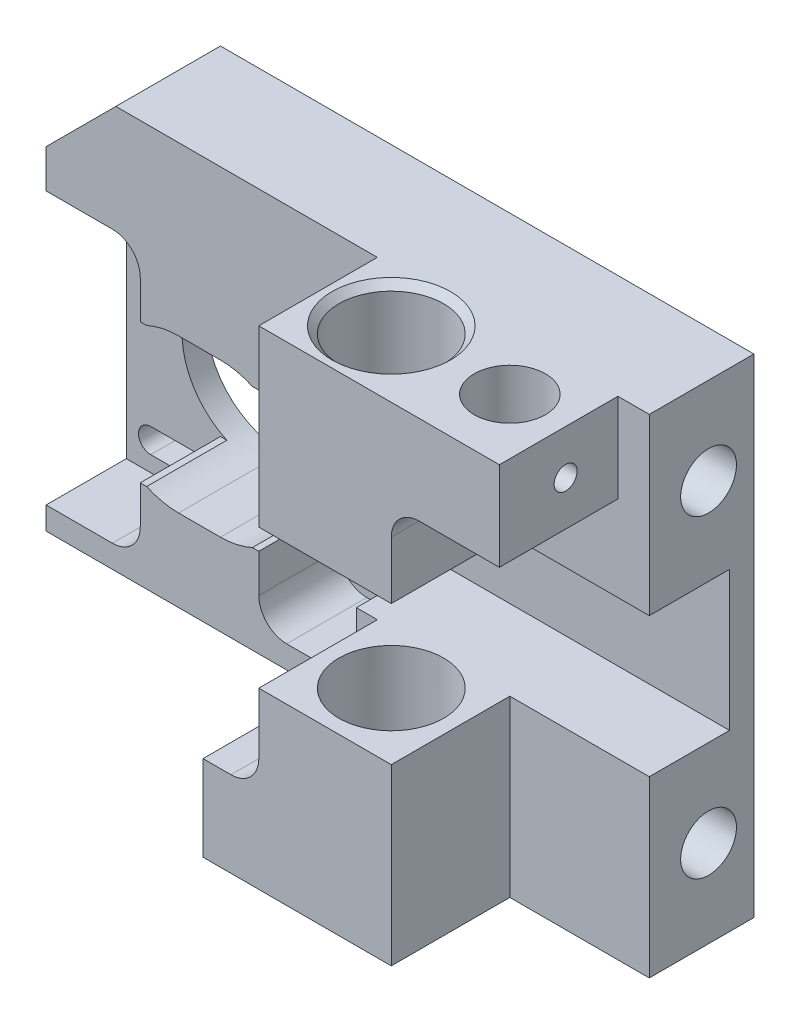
SolidWorks part; units mm, degrees
ref_plane "Plan de face" through (0, 0, 0) normal (0, 0, 1) x (1, 0, 0)
ref_plane "Plan de dessus" through (0, 0, 0) normal (0, 1, 0) x (1, 0, 0)
ref_plane "Plan de droite" through (0, 0, 0) normal (1, 0, 0) x (0, 0, -1)
sketch "Esquisse1" plane through (0, 0, 0) normal (0, 0, 1) x (1, 0, 0)
  line L0 (0, 0) -> (-6, 0) construction
  line L1 (0, -11) -> (-6, -11)
  line L2 (0, 11) -> (-6, 11)
  line L3 (0, 20.2026) -> (0, -14.7359) construction
  line L4 (-16.8352, 0) -> (12.3944, 0) construction
  line L5 (-15.5, 15.5) -> (-21.5, 15.5) construction
  line L6 (-15.5, 13.75) -> (-21.5, 13.75)
  line L7 (-15.5, 17.25) -> (-21.5, 17.25)
  line L8 (-15.5, -15.5) -> (-21.5, -15.5) construction
  line L9 (-15.5, -13.75) -> (-21.5, -13.75)
  line L10 (-15.5, -17.25) -> (-21.5, -17.25)
  line L11 (9.5, 15.5) -> (15.5, 15.5) construction
  line L12 (9.5, 17.25) -> (15.5, 17.25)
  line L13 (9.5, 13.75) -> (15.5, 13.75)
  line L14 (9.5, -15.5) -> (15.5, -15.5) construction
  line L15 (9.5, -17.25) -> (15.5, -17.25)
  line L16 (9.5, -13.75) -> (15.5, -13.75)
  line L17 (-25, 30.25) -> (-25, -22.75)
  line L18 (-25, -22.75) -> (14.5, -22.75)
  line L19 (14.5, -22.75) -> (14.5, -29.75)
  line L20 (14.5, -29.75) -> (61.5, -29.75)
  line L21 (61.5, -29.75) -> (61.5, 30.25)
  line L22 (61.5, 30.25) -> (-25, 30.25)
  arc A0 (0, -11) -> (0, 11) centre (0, 0) ccw
  arc A1 (-6, 11) -> (-6, -11) centre (-6, 0) ccw
  arc A2 (-15.5, 13.75) -> (-15.5, 17.25) centre (-15.5, 15.5) ccw
  arc A3 (-21.5, 17.25) -> (-21.5, 13.75) centre (-21.5, 15.5) ccw
  arc A4 (-15.5, -13.75) -> (-15.5, -17.25) centre (-15.5, -15.5) cw
  arc A5 (-21.5, -17.25) -> (-21.5, -13.75) centre (-21.5, -15.5) cw
  arc A6 (9.5, 17.25) -> (9.5, 13.75) centre (9.5, 15.5) ccw
  arc A7 (15.5, 13.75) -> (15.5, 17.25) centre (15.5, 15.5) ccw
  arc A8 (9.5, -17.25) -> (9.5, -13.75) centre (9.5, -15.5) cw
  arc A9 (15.5, -13.75) -> (15.5, -17.25) centre (15.5, -15.5) cw
  point P3 (-3, 0)
  point P14 (-18.5, 15.5)
  point P21 (-18.5, -15.5)
  point P28 (12.5, 15.5)
  point P35 (12.5, -15.5)
  dimension "D1" = 15.5
  dimension "D3" = 15.5
  dimension "D2" = 15.5
  dimension "D4" = 25
  dimension "D5" = 86.5
  dimension "D6" = 60
  dimension "D7" = 7
  dimension "D8" = 30.25
  dimension "D9" = 47
extrude "Boss.-Extru.1" add sketch "Esquisse1" along normal blind 32
sketch "Esquisse2" plane through (0, 0, 32) normal (0, 0, 1) x (1, 0, 0)
  line L0 (14.5, -21.75) -> (22.5, -21.75)
  line L1 (22.5, -21.75) -> (22.5, 30.25)
  line L2 (57, 30.25) -> (57, 22.25)
  line L3 (57, 22.25) -> (41.5, 22.25)
  line L4 (41.5, 22.25) -> (41.5, -29.75)
  line L5 (14.5, -22.75) -> (14.5, -21.75)
  line L6 (61.5, 30.25) -> (-25, 30.25)
  line L7 (-25, 30.25) -> (-25, -22.75)
  line L8 (-25, -22.75) -> (14.5, -22.75)
  line L9 (14.5, -22.75) -> (14.5, -29.75)
  line L10 (14.5, -29.75) -> (61.5, -29.75)
  line L11 (61.5, -29.75) -> (61.5, 30.25)
  line L12 (61.5, 30.25) -> (-25, 30.25)
  line L13 (-25, 30.25) -> (-25, -21.75)
  line L15 (14.5, -22.75) -> (14.5, -29.75)
  line L16 (14.5, -29.75) -> (61.5, -29.75)
  line L17 (61.5, -29.75) -> (61.5, 30.25)
  line L18 (14.5, -21.75) -> (-25, -21.75)
  dimension "D2" = 4.5
  dimension "D3" = 34.5
  dimension "D4" = 8
  dimension "D5" = 19
  dimension "D6" = 8
  dimension "D1" = 0
extrude "Enlèv. mat.-Extru.1" cut sketch "Esquisse2" against normal blind 17 contours L5 L0 L1 M17 M15 M16 M10 M7 M8 M9 M28 M25 M26 M27 M32 M29 M30 M31 M24 M21 M22 M23 M14 M11 M12 M13 | L3 L4 L2 M19 M20 M15
sketch "Esquisse3" plane through (0, 30.25, 0) normal (0, 1, 0) x (1, 0, 0)
  line L0 (22.5, -15) -> (22.5, -32) construction
  line L1 (61.5, 0) -> (-25, 0) construction
  circle A0 centre (32, -22.5) radius 7.5
  circle A1 centre (49, -22.5) radius 5
  dimension "D2" = 15
  dimension "D4" = 10
  dimension "D1" = 9.5
  dimension "D3" = 22.5
  dimension "D5" = 17
extrude "Enlèv. mat.-Extru.2" cut sketch "Esquisse3" against normal through all
sketch "Esquisse4" plane through (61.5, 0, 0) normal (1, 0, 0) x (0, 0, -1)
  line L1 (-15, 30.25) -> (0, 30.25) construction
  line L4 (-15, -29.75) -> (-15, 30.25) construction
  line L5 (-15, 22.25) -> (-15, -29.75) construction
  point P0 (-6.5, 24.3339)
  point P1 (-6.5, -20.6661)
  point P4 (-7.5, 30.25)
  dimension "D1" = 6
  dimension "D2" = 45
  dimension "D3" = 8.5
  dimension "D4" = 8.5
hole_wizard "Dégagement M81" positions "Esquisse6" profile "Esquisse5" hole size "M8" standard "ISO"
sketch "Esquisse6" plane through (61.5, 0, 0) normal (1, 0, 0) x (0, 0, -1)
  line L0 (-15, 0) -> (0, 0) construction
  line L1 (0, -29.75) -> (0, 30.25) construction
  point P0 (-6.5, 22.5)
  point P3 (-6.5, -22.5)
  dimension "D1" = 22.5
  dimension "D2" = 45
  dimension "D3" = 6.5
sketch "Esquisse5" plane through (61.5, 22.5, 6.5) normal (0, 1, 0) x (0, 0, -1)
  line L0 (0, 0) -> (0, 42.6651)
  line L1 (0, 42.6651) -> (3.75, 40.5)
  line L2 (3.75, 40.5) -> (3.75, 0)
  line L5 (3.75, 0) -> (0, 0)
  line L10 (0, 42.6651) -> (-3.75, 40.5) construction
  line L11 (0, -6.35) -> (0, 107.95) construction
  dimension "Diamètre du perçage" = 7.5
  dimension "Profondeur du perçage" = 40.5
  dimension "Angle de pointe" = 120
chamfer "Chanfrein2" [suppressed] distance 0.5 angle 45
sketch "Esquisse9" plane through (0, -21.75, 0) normal (0, 1, 0) x (1, 0, 0)
  line L1 (-25, -32) -> (22.5, -32) construction
  point P0 (19, -20.5)
  dimension "D2" = 11.5
hole_wizard "Trou taraudé M41" positions "Esquisse11" profile "Esquisse10" tap size "M4" standard "ISO"
sketch "Esquisse11" plane through (0, -21.75, 0) normal (0, 1, 0) x (1, 0, 0)
  point P0 (19, -20.5)
sketch "Esquisse10" plane through (19, -21.75, 20.5) normal (1, 0, 0) x (0, 0, 1)
  line L0 (0, 0) -> (0, 8)
  line L1 (0, 8) -> (1.65, 8)
  line L2 (1.65, 8) -> (1.65, 0)
  line L5 (1.65, 0) -> (0, 0)
  line L11 (0, -6.35) -> (0, 107.95) construction
  dimension "Diamètre du trou pour taraudage jusqu'au prochain" = 3.3
  dimension "Profondeur du trou pour taraudage jusqu'au prochain" = 8
sketch "Esquisse12" plane through (61.5, 0, 0) normal (1, 0, 0) x (0, 0, -1)
  line L0 (-8.5, 5) -> (-8.5, -5) construction
  line L1 (-3.5, 5) -> (-3.5, -5)
  line L2 (-13.5, 5) -> (-13.5, -5)
  line L3 (-15, 0) -> (0, 0) construction
  line L4 (0, -29.75) -> (0, 30.25) construction
  arc A0 (-3.5, 5) -> (-13.5, 5) centre (-8.5, 5) ccw
  arc A1 (-13.5, -5) -> (-3.5, -5) centre (-8.5, -5) ccw
  point P2 (-8.5, 0)
  dimension "D1" = 8.5
extrude "Enlèv. mat.-Extru.4" cut sketch "Esquisse12" against normal through all
fillet "Congé1" radius 4 2 edges at (22.5, -21.75, 23.5) (41.5, 22.25, 23.5)
sketch "Esquisse14" plane through (0, 30.25, 0) normal (0, 1, 0) x (1, 0, 0)
  line L1 (-25, -15) -> (-25, 0) construction
  line L2 (-25, -15) -> (-25, 0)
  line L8 (61.5, 0) -> (-25, 0)
  line L9 (-25, 0) -> (-25, -15)
  line L10 (-25, -15) -> (22.5, -15)
  line L11 (22.5, -15) -> (22.5, -32)
  line L12 (22.5, -32) -> (57, -32)
  line L13 (57, -32) -> (57, -15)
  line L14 (57, -15) -> (61.5, -15)
  line L15 (61.5, -15) -> (61.5, 0)
  line L16 (61.5, 0) -> (-25, 0)
  line L18 (-25, -15) -> (22.5, -15)
  line L19 (22.5, -15) -> (22.5, -32)
  line L20 (22.5, -32) -> (57, -32)
  line L21 (57, -32) -> (57, -15)
  line L22 (57, -15) -> (61.5, -15)
  line L23 (61.5, -15) -> (61.5, 0)
  line L26 (-25, 0) -> (-25, -15)
  circle A1 centre (32, -22.5) radius 7.5
  circle A2 centre (49, -22.5) radius 5 construction
  circle A3 centre (49, -22.5) radius 5
  dimension "D1" = 0
sketch "Esquisse15" plane through (0, -29.75, 0) normal (0, -1, 0) x (1, 0, 0)
  line L6 (61.5, 15) -> (41.5, 15)
  line L7 (41.5, 15) -> (41.5, 32)
  line L8 (41.5, 32) -> (14.5, 32)
  line L9 (14.5, 32) -> (14.5, 0)
  line L10 (14.5, 0) -> (61.5, 0)
  line L11 (61.5, 0) -> (61.5, 15)
  line L12 (61.5, 15) -> (41.5, 15)
  line L13 (41.5, 15) -> (41.5, 32)
  line L14 (41.5, 32) -> (14.5, 32)
  line L15 (14.5, 32) -> (14.5, 0)
  line L16 (14.5, 0) -> (61.5, 0)
  line L17 (61.5, 0) -> (61.5, 15)
  circle A0 centre (32, 22.5) radius 7.5 construction
  circle A1 centre (32, 22.5) radius 7.5
  circle A2 centre (19, 20.5) radius 1.65 construction
  circle A3 centre (19, 20.5) radius 1.65
  dimension "D1" = 0
extrude "Boss.-Extru.3" add sketch "Esquisse15" along normal blind 4.75
sketch "Esquisse16" plane through (0, 0, 3.5) normal (0, 0, 1) x (1, 0, 0)
  line L1 (-26.9682, 10) -> (63.4682, 10)
  line L2 (-26.9682, 10) -> (-26.9682, -10)
  line L3 (-26.9682, -10) -> (63.4682, -10)
  line L4 (63.4682, 10) -> (63.4682, -10)
  dimension "D1" = 20
  dimension "D2" = 10
extrude "Enlèv. mat.-Extru.6" cut sketch "Esquisse16" along normal through all
extrude "Boss.-Extru.4" add sketch "Esquisse14" along normal blind 4.75 contours M14 M15 M16 M17 M18 M11 M22 M13 M21 M10
chamfer "Chanfrein4" distance 10 angle 45 1 edges at (-25, 35, 7.5)
sketch "Esquisse17" plane through (0, 0, 15) normal (0, 0, 1) x (1, 0, 0)
  line L1 (-27.679, -19.6932) -> (14.5, -19.6932)
  line L2 (-27.679, -19.6932) -> (-27.679, -22.75)
  line L3 (-27.679, -22.75) -> (14.5, -22.75)
  line L4 (14.5, -19.6932) -> (14.5, -22.75)
extrude "Enlèv. mat.-Extru.7" cut sketch "Esquisse17" along normal through all
sketch "Esquisse18" plane through (0, 0, 15) normal (0, 0, 1) x (1, 0, 0)
  line L0 (22.5, -17.75) -> (22.5, -10) construction
  line L1 (22.5, -17.75) -> (22.5, -10)
  line L2 (-25, -22.75) -> (14.5, -22.75) construction
  line L3 (-25, -22.75) -> (14.5, -22.75)
  line L4 (14.5, -22.75) -> (18.5, -22.75)
  line L5 (22.5, -18.75) -> (22.5, -17.75)
  line L6 (22.5, -17.75) -> (14.5, -17.75)
  line L7 (14.5, -17.75) -> (14.5, -22.75)
  arc A0 (18.5, -22.75) -> (22.5, -18.75) centre (18.5, -18.75) ccw
  dimension "D1" = 4
extrude "Enlèv. mat.-Extru.9" cut sketch "Esquisse18" along normal through all contours L6 L7 M6 M7 | L4 A0 L5 M7 M6 M5
chamfer "Chanfrein5" distance 1 angle 45 1 edges at (24.5, 35, 22.5)
sketch "Esquisse19" plane through (0, 35, 0) normal (0, 1, 0) x (1, 0, 0)
  line L0 (49, -22.5) -> (49, -35.1099) construction
  line L1 (45, -26.5) -> (45, -34.2037)
  line L3 (53, -26.5) -> (53, -18.5)
  line L5 (45, -26.5) -> (45, -18.5)
  line L6 (52.5355, -26.0355) -> (45, -18.5) construction
  line L7 (53, -18.5) -> (45.4645, -26.0355) construction
  line L8 (45, -34.2037) -> (53, -34.2037)
  line L9 (53, -34.2037) -> (53, -26.5)
  circle A0 centre (49, -22.5) radius 5 construction
  circle A1 centre (49, -22.5) radius 5
  arc A2 (45, -18.5) -> (53, -18.5) centre (49, -18.5) cw
  dimension "D1" = 8
extrude "Enlèv. mat.-Extru.10" [suppressed] cut sketch "Esquisse19" against normal blind 5
sketch "Esquisse20" plane through (0, 0, 15) normal (0, 0, 1) x (1, 0, 0)
  line L1 (-29.0367, 19.5) -> (-15.5, 19.5)
  line L2 (-29.0367, 19.5) -> (-29.0367, 9.7305)
  line L3 (-29.0367, 9.7305) -> (-11.5, 9.7305)
  line L4 (-11.5, 15.5) -> (-11.5, 9.7305)
  line L6 (-11.5, -9.1893) -> (-28.7184, -9.1893)
  line L7 (-11.5, -9.1893) -> (-11.5, -15.5)
  line L8 (-15.5, -19.5) -> (-28.7184, -19.5)
  line L9 (-28.7184, -9.1893) -> (-28.7184, -19.5)
  line L11 (9.5, 19.5) -> (15.5, 19.5)
  line L12 (5.5, 15.5) -> (5.5, 9.5464)
  line L13 (5.5, 9.5464) -> (19.5, 9.5464)
  line L14 (19.5, 15.5) -> (19.5, 9.5464)
  line L15 (19.5, -9.4898) -> (5.5, -9.4898)
  line L16 (19.5, -9.4898) -> (19.5, -15.5)
  line L17 (15.5, -19.5) -> (9.5, -19.5)
  line L18 (5.5, -9.4898) -> (5.5, -15.5)
  arc A0 (19.5, -15.5) -> (15.5, -19.5) centre (15.5, -15.5) cw
  arc A1 (9.5, -19.5) -> (5.5, -15.5) centre (9.5, -15.5) cw
  arc A2 (-11.5, -15.5) -> (-15.5, -19.5) centre (-15.5, -15.5) cw
  arc A3 (15.5, 19.5) -> (19.5, 15.5) centre (15.5, 15.5) cw
  arc A4 (9.5, 19.5) -> (5.5, 15.5) centre (9.5, 15.5) ccw
  arc A5 (-15.5, 19.5) -> (-11.5, 15.5) centre (-15.5, 15.5) cw
  point P35 (5.5, 19.5)
  point P38 (-11.5, 19.5)
  dimension "D6" = 4
  dimension "D1" = 4
  dimension "D2" = 4
  dimension "D3" = 4
  dimension "D4" = 4
  dimension "D5" = 4
extrude "Enlèv. mat.-Extru.11" cut sketch "Esquisse20" against normal blind 11.5
sketch "Esquisse22" plane through (0, -34.5, 0) normal (0, -1, 0) x (1, 0, 0)
  line L6 (61.5, 0) -> (61.5, 15)
  line L7 (61.5, 15) -> (41.5, 15)
  line L8 (41.5, 15) -> (41.5, 32)
  line L9 (41.5, 32) -> (14.5, 32)
  line L10 (14.5, 32) -> (14.5, 0)
  line L11 (14.5, 0) -> (61.5, 0)
  line L12 (61.5, 0) -> (61.5, 15)
  line L13 (61.5, 15) -> (41.5, 15)
  line L14 (41.5, 15) -> (41.5, 32)
  line L15 (41.5, 32) -> (14.5, 32)
  line L16 (14.5, 32) -> (14.5, 0)
  line L17 (14.5, 0) -> (61.5, 0)
  circle A0 centre (19, 20.5) radius 1.65 construction
  circle A1 centre (19, 20.5) radius 1.65
  circle A4 centre (32, 22.5) radius 7.5
  dimension "D1" = 0
extrude "Boss.-Extru.6" add sketch "Esquisse22" along normal blind 0.5
chamfer "Chanfrein7" distance 1 angle 45 1 edges at (32, -35, 15)
hole_wizard "Trou taraudé M42" positions "Esquisse24" profile "Esquisse23" tap size "M4" standard "ISO"
sketch "Esquisse24" plane through (57, 0, 0) normal (1, 0, 0) x (0, 0, -1)
  line L0 (-22.5, 10) -> (-22.5, 34) construction
  line L1 (-32, 35) -> (-15, 35) construction
  point P0 (-22.5, 28.625)
  dimension "D1" = 6.375
sketch "Esquisse23" plane through (57, 28.625, 22.5) normal (0, 1, 0) x (0, 0, -1)
  line L0 (0, 0) -> (0, 3)
  line L1 (0, 3) -> (1.65, 3)
  line L2 (1.65, 3) -> (1.65, 0)
  line L5 (1.65, 0) -> (0, 0)
  line L11 (0, -6.35) -> (0, 107.95) construction
  dimension "Diamètre du trou pour taraudage jusqu'au prochain" = 3.3
  dimension "Profondeur du trou pour taraudage jusqu'au prochain" = 3
hole_wizard "Trou taraudé M121" positions "Esquisse30" profile "Esquisse29" tap size "M12" standard "ISO"
sketch "Esquisse30" plane through (0, 35, 0) normal (0, 1, 0) x (1, 0, 0)
  point P0 (49, -22.5)
sketch "Esquisse29" plane through (49, 35, 22.5) normal (1, 0, 0) x (0, 0, 1)
  line L0 (0, 0) -> (0, 70)
  line L1 (0, 70) -> (5.1, 70)
  line L2 (5.1, 70) -> (5.1, 0)
  line L5 (5.1, 0) -> (0, 0)
  line L11 (0, -6.35) -> (0, 107.95) construction
  dimension "Diamètre du trou pour taraudage jusqu'au prochain" = 10.2
  dimension "Profondeur du trou pour taraudage jusqu'au prochain" = 70
ref_plane "Plan1" through (61.5, 35, 0) normal (0, 1, 0) x (1, 0, 0)
sketch "Esquisse31" plane through (61.5, 0, 0) normal (1, 0, 0) x (0, 0, -1)
  circle A0 centre (-6.5, 22.5) radius 4
  circle A1 centre (-6.5, -22.5) radius 4
  dimension "D1" = 8
  dimension "D2" = 8
extrude "Enlèv. mat.-Extru.12" cut sketch "Esquisse31" against normal blind 39.5
